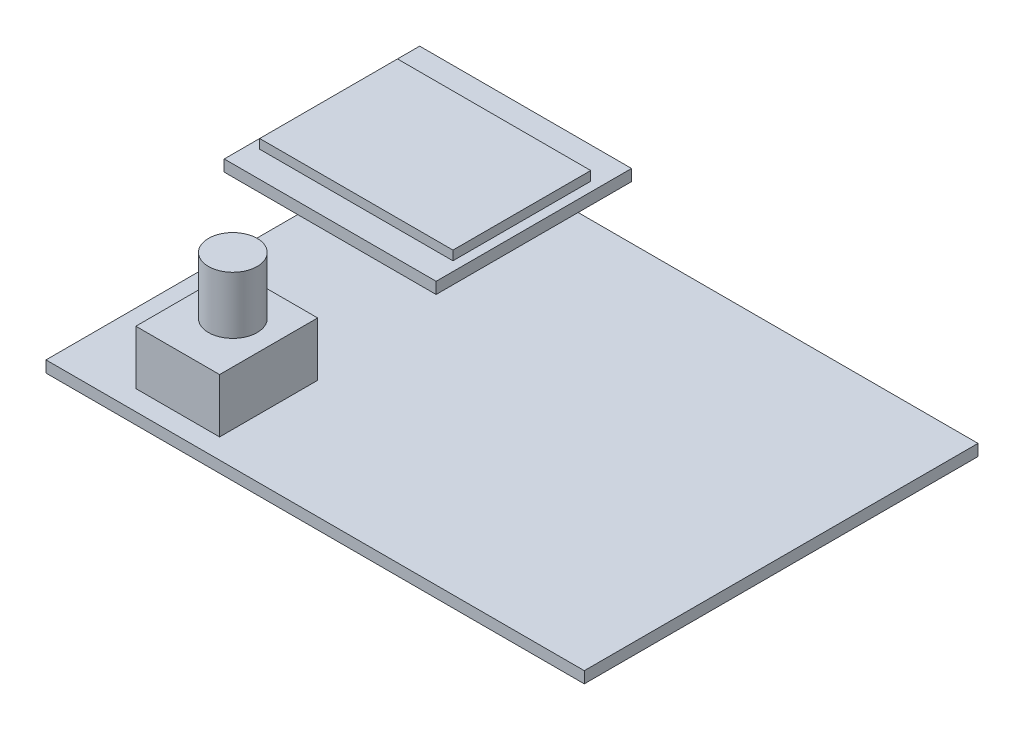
SolidWorks part; units mm, degrees
ref_plane "Front Plane" through (0, 0, 0) normal (0, 0, 1) x (1, 0, 0)
ref_plane "Top Plane" through (0, 0, 0) normal (0, 1, 0) x (1, 0, 0)
ref_plane "Right Plane" through (0, 0, 0) normal (1, 0, 0) x (0, 0, -1)
sketch "Sketch2" plane through (-45.85, 0, 0) normal (-1, 0, 0) x (0, 0, 1)
  line L0 (-25.05, 1.2) -> (3.55, 1.2) construction
  line L1 (-27.55, 39.8) -> (27.45, 39.8)
  line L2 (-27.55, 39.8) -> (-27.55, 38.2)
  line L3 (-27.55, 38.2) -> (27.45, 38.2)
  line L4 (27.45, 39.8) -> (27.45, 38.2)
  line L5 (-25.05, 1.2) -> (-25.05, 0) construction
  dimension "D1" = 1.6
  dimension "D2" = 55
  dimension "D3" = 37
  dimension "D4" = 2.5
extrude "Boss-Extrude1" add sketch "Sketch2" against normal blind 75.2 contours L1 L4 L3 L2
ref_plane "Plane1" through (0, 52.06, 0) normal (0, 1, 0) x (1, 0, 0)
sketch "Sketch4" plane through (0, 52.06, 0) normal (0, 1, 0) x (1, 0, 0)
  line L0 (-45.85, 27.55) -> (-45.85, -27.45) construction
  line L1 (-43.85, 22.75) -> (-14.25, 22.75)
  line L2 (-43.85, 22.75) -> (-43.85, -4.55)
  line L3 (-43.85, -4.55) -> (-14.25, -4.55)
  line L4 (-14.25, 22.75) -> (-14.25, -4.55)
  line L5 (-43.85, 22.75) -> (-14.25, -4.55) construction
  line L6 (-43.85, -4.55) -> (-14.25, 22.75) construction
  line L7 (29.35, 27.55) -> (-45.85, 27.55) construction
  point P0 (-29.05, 9.1)
  dimension "D1" = 2
  dimension "D2" = 4.8
  dimension "D3" = 27.3
  dimension "D4" = 29.6
extrude "Boss-Extrude2" add sketch "Sketch4" along normal blind 1.6 separate body
sketch "Sketch5" plane through (0, 53.66, 0) normal (0, 1, 0) x (1, 0, 0)
  line L0 (-14.25, 22.75) -> (-43.85, 22.75) construction
  line L1 (-42.55, 18.35) -> (-15.55, 18.35)
  line L2 (-42.55, 18.35) -> (-42.55, -0.9)
  line L3 (-42.55, -0.9) -> (-15.55, -0.9)
  line L4 (-15.55, 18.35) -> (-15.55, -0.9)
  line L5 (-42.55, 18.35) -> (-15.55, -0.9) construction
  line L6 (-42.55, -0.9) -> (-15.55, 18.35) construction
  line L7 (-43.85, 22.75) -> (-43.85, -4.55) construction
  line L8 (-14.25, -4.55) -> (-14.25, 22.75) construction
  point P0 (-29.05, 8.725)
  dimension "D1" = 4.4
  dimension "D2" = 1.3
  dimension "D3" = 1.3
  dimension "D4" = 19.25
extrude "Boss-Extrude3" add sketch "Sketch5" along normal blind 1.3 contours L2 L1 L4 L3
sketch "Sketch6" plane through (0, 39.8, 0) normal (0, 1, 0) x (1, 0, 0)
  line L0 (-45.85, 27.55) -> (-45.85, -27.45) construction
  line L1 (-36.1, -10.95) -> (-24.4, -10.95)
  line L2 (-36.1, -10.95) -> (-36.1, -24.65)
  line L3 (-36.1, -24.65) -> (-24.4, -24.65)
  line L4 (-24.4, -10.95) -> (-24.4, -24.65)
  line L5 (-36.1, -10.95) -> (-24.4, -24.65) construction
  line L6 (-36.1, -24.65) -> (-24.4, -10.95) construction
  line L7 (29.35, -27.45) -> (-45.85, -27.45) construction
  point P0 (-30.25, -17.8)
  dimension "D1" = 9.75
  dimension "D2" = 2.8
  dimension "D3" = 13.7
  dimension "D4" = 11.7
extrude "Boss-Extrude4" add sketch "Sketch6" along normal blind 7.55
sketch "Sketch7" plane through (0, 47.35, 0) normal (0, 1, 0) x (1, 0, 0)
  line L0 (-24.4, -10.95) -> (-36.1, -10.95) construction
  line L1 (-36.1, -10.95) -> (-36.1, -24.65) construction
  circle A0 centre (-30.25, -16.95) radius 3.4
  dimension "D1" = 6
  dimension "D3" = 6.8
  dimension "D2" = 5.85
extrude "Boss-Extrude5" add sketch "Sketch7" along normal blind 8
